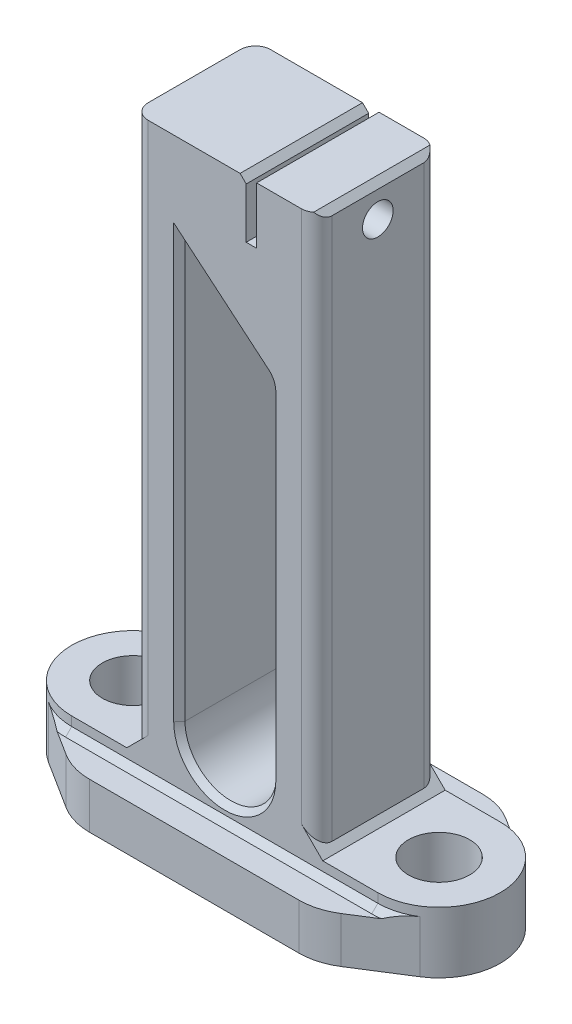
SolidWorks part; units mm, degrees
ref_plane "Ebene vorne" through (0, 0, 0) normal (0, 0, 1) x (1, 0, 0)
ref_plane "Ebene oben" through (0, 0, 0) normal (0, 1, 0) x (1, 0, 0)
ref_plane "Ebene rechts" through (0, 0, 0) normal (1, 0, 0) x (0, 0, -1)
sketch "Skizze1" plane through (0, 0, 0) normal (0, 0, 1) x (1, 0, 0)
  line L0 (0, 0) -> (0, 9.25)
  line L1 (0, 9.25) -> (-18.5, 9.25)
  line L2 (-18.5, 9.25) -> (-18.5, -91.25)
  line L3 (-18.5, -91.25) -> (11.5, -91.25)
  line L4 (11.5, -91.25) -> (11.5, 9.25)
  line L5 (11.5, 9.25) -> (1.7, 9.25)
  line L6 (1.7, 9.25) -> (1.7, 0)
  line L7 (1.7, 0) -> (0, 0)
  dimension "D1" = 9.25
  dimension "D2" = 18.5
  dimension "D3" = 1.7
  dimension "D4" = 9.25
  dimension "D5" = 30
  dimension "D6" = 91.25
extrude "Aufsatz-Linear austragen1" add sketch "Skizze1" along normal mid plane 20
sketch "Skizze2" plane through (0, -91.25, 0) normal (0, -1, 0) x (1, 0, 0)
  line L0 (0, 0) -> (21.5, 0) construction
  line L1 (-3.5, 10) -> (-3.5, -10) construction
  line L2 (-18.5, 10) -> (11.5, 10) construction
  line L3 (-18.5, -10) -> (11.5, -10) construction
  line L4 (11.5, 10) -> (11.5, -10) construction
  line L5 (21.5, 0) -> (21.5, 10) construction
  line L6 (21.5, 0) -> (31.5, 0) construction
  line L7 (11.5, 10) -> (21.5, 10)
  line L8 (11.5, 10) -> (11.5, -10)
  line L9 (11.5, -10) -> (21.5, -10)
  line L11 (-18.5, 10) -> (-18.5, -10)
  line L12 (-18.5, -10) -> (-28.5, -10)
  line L13 (-18.5, 10) -> (-28.5, 10)
  circle A0 centre (21.5, 0) radius 5
  arc A1 (21.5, 10) -> (31.5, 0) centre (21.5, 0) cw
  arc A2 (21.5, -10) -> (31.5, 0) centre (21.5, 0) ccw
  circle A3 centre (-28.5, 0) radius 5
  arc A4 (-28.5, -10) -> (-38.5, 0) centre (-28.5, 0) cw
  arc A5 (-28.5, 10) -> (-38.5, 0) centre (-28.5, 0) ccw
  point P21 (11.5, 0)
  dimension "D2" = 10
  dimension "D1" = 10
extrude "Aufsatz-Linear austragen2" add sketch "Skizze2" against normal blind 10
sketch "Skizze3" plane through (11.5, 0, 0) normal (1, 0, 0) x (0, 0, -1)
  line L0 (0, 9.25) -> (0, 4) construction
  line L1 (-10, 9.25) -> (10, 9.25) construction
  circle A0 centre (0, 4) radius 1.5
  dimension "D2" = 3
  dimension "D1" = 5.25
extrude "Schnitt-Linear austragen3" cut sketch "Skizze3" against normal through all
chamfer "Fase1" distance 1 angle 45 4 edges at (-18.5, -81.25, 0) (11.5, -81.25, 0) (0, 9.25, 0) (11.5, 9.25, 0)
sketch "Skizze5" plane through (0, 0, -10) normal (0, 0, -1) x (-1, 0, 0)
  line L0 (3.5, -91.25) -> (3.5, -11.25) construction
  line L1 (28.5, -91.25) -> (-21.5, -91.25) construction
  line L2 (3.5, -81.25) -> (-12.5, -81.25) construction
  line L3 (11, -73.75) -> (11, -17.5432)
  line L5 (-4, -73.75) -> (-4, -17.5432)
  line L6 (-4, -17.5432) -> (3.5, -11.25)
  line L7 (11, -17.5432) -> (11, -4.9568)
  line L8 (11, -4.9568) -> (3.5, -11.25)
  arc A0 (-4, -73.75) -> (11, -73.75) centre (3.5, -73.75) ccw
  dimension "D1" = 15
  dimension "D2" = 70
  dimension "D3" = 50
extrude "Schnitt-Linear austragen5" cut sketch "Skizze5" against normal through all and the other way through all
fillet "Verrundung2" radius 2.5 1 edges at (4, -17.5432, 0)
fillet "Verrundung1" radius 2.5 4 edges at (-18.5, -35.5, -10) (-18.5, -35.5, 10) (11.5, -36, 10) (11.5, -36, -10)
sketch "Skizze4" plane through (11.5, 0, 0) normal (1, 0, 0) x (0, 0, -1)
  circle A2 centre (0, 4) radius 2.5
  circle A3 centre (0, 4) radius 2.5
  dimension "D1" = 1
extrude "Schnitt-Linear austragen4" cut sketch "Skizze4" against normal up to next
chamfer "Fase4" distance 1 angle 40 10 edges at (-3.9465, -10.8753, -10) (-3.9465, -10.8753, 10) (-11, -39.3534, -10) (-11, -39.3534, 10) (3.7658, -17.6525, 10) (3.7658, -17.6525, -10) (-3.5, -81.25, -10) (-3.5, -81.25, 10) (4, -46.2295, 10) (4, -46.2295, -10)
sketch "Skizze6" plane through (0, -91.25, 0) normal (0, -1, 0) x (-1, 0, 0)
  line L0 (0, 0) -> (38.5, 0) construction
  line L1 (3.5, 10) -> (3.5, 15) construction
  line L2 (28.5, 10) -> (-21.5, 10) construction
  line L3 (-16.5, 15) -> (23.5, 15)
  line L4 (23.5, 15) -> (33.8485, 8.4495)
  line L5 (28.5, 10) -> (-21.5, 10)
  line L6 (-16.5, 15) -> (-26.8485, 8.4495)
  line L7 (23.5, 15) -> (33.8485, 8.4495)
  line L8 (-16.5, 15) -> (-26.8485, 8.4495)
  line L9 (3.5, -10) -> (3.5, -15) construction
  line L10 (-16.5, -15) -> (-26.8485, -8.4495)
  line L11 (23.5, -15) -> (33.8485, -8.4495)
  line L12 (-16.5, -15) -> (-26.8485, -8.4495)
  line L13 (28.5, -10) -> (-21.5, -10)
  line L14 (23.5, -15) -> (33.8485, -8.4495)
  line L15 (-16.5, -15) -> (23.5, -15)
  arc A0 (28.5, -10) -> (28.5, 10) centre (28.5, 0) ccw construction
  arc A1 (-26.8485, 8.4495) -> (-21.5, 10) centre (-21.5, 0) cw
  arc A2 (33.8485, 8.4495) -> (28.5, 10) centre (28.5, 0) ccw
  arc A3 (-26.8485, 8.4495) -> (-21.5, 10) centre (-21.5, 0) cw
  arc A4 (33.8485, 8.4495) -> (28.5, 10) centre (28.5, 0) ccw
  arc A5 (33.8485, -8.4495) -> (28.5, -10) centre (28.5, 0) cw
  arc A6 (-26.8485, -8.4495) -> (-21.5, -10) centre (-21.5, 0) ccw
  arc A7 (33.8485, -8.4495) -> (28.5, -10) centre (28.5, 0) cw
  arc A8 (-26.8485, -8.4495) -> (-21.5, -10) centre (-21.5, 0) ccw
  dimension "D1" = 5
  dimension "D2" = 20
extrude "Aufsatz-Linear austragen3" add sketch "Skizze6" against normal blind 7.5 contours L3 L6 L4 M10 M9 M12 | L10 L15 L11 M12 M11 M10
fillet "Verrundung3" radius 10 4 edges at (16.5, -87.5, -15) (16.5, -87.5, 15) (-23.5, -87.5, 15) (-23.5, -87.5, -15)
chamfer "Fase5" distance 1 angle 45 6 edges at (24.2843, -83.75, 9.6046) (-31.2843, -83.75, 9.6046) (-3.5, -83.75, 10) (-31.2843, -83.75, -9.6046) (24.2843, -83.75, -9.6046) (-3.5, -83.75, -10)
